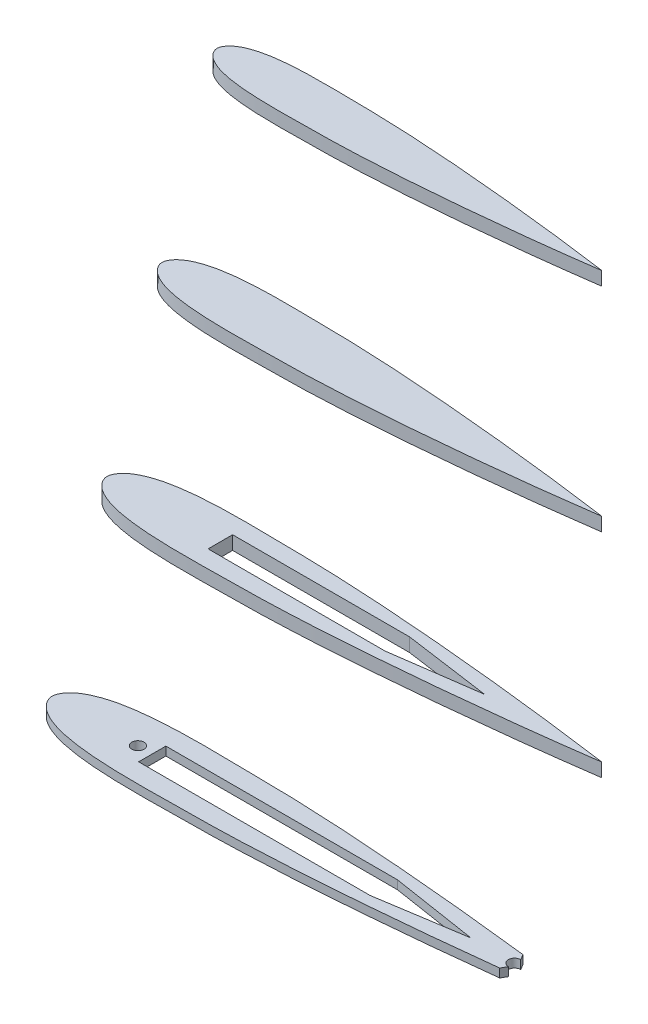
SolidWorks part; units mm, degrees
ref_plane "Front Plane" through (0, 0, 0) normal (0, 0, 1) x (1, 0, 0)
ref_plane "Top Plane" through (0, 0, 0) normal (0, 1, 0) x (1, 0, 0)
ref_plane "Right Plane" through (0, 0, 0) normal (1, 0, 0) x (0, 0, -1)
sketch "Sketch1" plane through (0, 0, 0) normal (0, 1, 0) x (1, 0, 0)
  line L0 (-1.045, -0.5826) -> (-1.018, -0.5993)
  spline S0 degree 3 poles (-1.045, -0.5826) (-4.9621, -0.0429) (-12.2075, 0.9632) (-22.7943, 2.3133) (-32.7945, 3.5249) (-46.1237, 5.0426) (-59.4574, 6.4326) (-72.7951, 7.6863) (-82.7953, 8.5461) (-92.7951, 9.3271) (-102.8619, 10.0159) (-112.9283, 10.6053) (-122.9958, 11.0416) (-132.9965, 11.3641) (-141.266, 11.3585) (-147.865, 11.5121) (-156.1318, 11.6272) (-166.1409, 11.6323) (-176.149, 11.1038) (-182.4812, 10.3989) (-186.8231, 9.6869) (-190.1592, 8.9277) (-192.8179, 8.1239) (-194.8303, 7.3884) (-196.8545, 6.4661) (-198.9145, 5.2576) (-200.6234, 3.8444) (-202.1284, 1.9526) (-203.2362, -0.5928) (-202.1284, -3.1381) (-200.6234, -5.0299) (-198.9145, -6.4432) (-196.8545, -7.6516) (-194.8303, -8.5739) (-192.8179, -9.3094) (-190.1592, -10.1132) (-186.8231, -10.8724) (-182.4812, -11.5844) (-176.149, -12.2893) (-166.1409, -12.8178) (-156.1318, -12.8128) (-147.865, -12.6976) (-141.266, -12.544) (-132.9965, -12.5496) (-122.9958, -12.2272) (-112.9283, -11.7908) (-102.8619, -11.2014) (-92.7951, -10.5127) (-82.7953, -9.7316) (-72.7951, -8.8718) (-59.4574, -7.6181) (-46.1237, -6.2281) (-32.7945, -4.7104) (-22.7943, -3.4989) (-12.1985, -2.1475) (-4.9442, -1.1402) (-1.018, -0.5993) knots -0.004321 -0.004321 -0.004321 -0.004321 0.024634 0.049243 0.07383 0.098397 0.147479 0.171995 0.196494 0.220976 0.245442 0.27038 0.294813 0.319232 0.343642 0.35536 0.367566 0.404183 0.428636 0.44092 0.450818 0.460843 0.465946 0.471149 0.476523 0.482208 0.488618 0.492568 0.5 0.507432 0.511382 0.517792 0.523477 0.528851 0.534054 0.539157 0.549182 0.55908 0.571364 0.595817 0.632434 0.64464 0.656358 0.680768 0.705187 0.72962 0.754558 0.779024 0.803506 0.828005 0.852521 0.901603 0.92617 0.950757 0.975366 1.004387 1.004387 1.004387 1.004387
ref_plane "Plane1" through (0, 234.38, 0) normal (0, 1, 0) x (1, 0, 0)
sketch "Sketch2" plane through (0, 234.38, 0) normal (0, 1, 0) x (1, 0, 0)
  line L0 (-1.045, -0.5826) -> (-1.0261, -0.5942)
  line L1 (-1.045, -0.5826) -> (-142.2725, -0.5826) construction
  spline S0 degree 3 poles (-1.045, -0.5826) (-3.787, -0.2048) (-8.8587, 0.4995) (-16.2695, 1.4446) (-23.2696, 2.2927) (-32.6001, 3.355) (-41.9337, 4.328) (-51.27, 5.2056) (-58.2702, 5.8075) (-65.2701, 6.3542) (-72.3168, 6.8363) (-79.3633, 7.2489) (-86.4106, 7.5544) (-93.411, 7.7801) (-99.1997, 7.7762) (-103.819, 7.8837) (-109.6058, 7.9643) (-116.6121, 7.9678) (-123.6178, 7.5979) (-128.0503, 7.1044) (-131.0897, 6.6061) (-133.4249, 6.0746) (-135.286, 5.5119) (-136.6947, 4.9971) (-138.1116, 4.3515) (-139.5537, 3.5056) (-140.7499, 2.5163) (-141.8034, 1.1921) (-142.5788, -0.5897) (-141.8034, -2.3715) (-140.7499, -3.6957) (-139.5537, -4.685) (-138.1116, -5.5309) (-136.6947, -6.1765) (-135.286, -6.6913) (-133.4249, -7.254) (-131.0897, -7.7855) (-128.0503, -8.2838) (-123.6178, -8.7773) (-116.6121, -9.1472) (-109.6058, -9.1437) (-103.819, -9.0631) (-99.1997, -8.9555) (-93.411, -8.9595) (-86.4106, -8.7338) (-79.3633, -8.4283) (-72.3168, -8.0157) (-65.2701, -7.5336) (-58.2702, -6.9869) (-51.27, -6.385) (-41.9337, -5.5074) (-32.6001, -4.5344) (-23.2696, -3.4721) (-16.2695, -2.624) (-8.8524, -1.678) (-3.7744, -0.9729) (-1.0261, -0.5942) knots -0.004321 -0.004321 -0.004321 -0.004321 0.024634 0.049243 0.07383 0.098397 0.147479 0.171995 0.196494 0.220976 0.245442 0.27038 0.294813 0.319232 0.343642 0.35536 0.367566 0.404183 0.428636 0.44092 0.450818 0.460843 0.465946 0.471149 0.476523 0.482208 0.488618 0.492568 0.5 0.507432 0.511382 0.517792 0.523477 0.528851 0.534054 0.539157 0.549182 0.55908 0.571364 0.595817 0.632434 0.64464 0.656358 0.680768 0.705187 0.72962 0.754558 0.779024 0.803506 0.828005 0.852521 0.901603 0.92617 0.950757 0.975366 1.004387 1.004387 1.004387 1.004387
  point P2 (-1.045, -0.5826)
ref_plane "Plane3" through (0, 78.126, 0) normal (0, 1, 0) x (1, 0, 0)
ref_plane "Plane4" through (0, 156.252, 0) normal (0, 1, 0) x (1, 0, 0)
sketch "Sketch3" plane through (0, 78.126, 0) normal (0, 1, 0) x (1, 0, 0)
  line L0 (-1.045, -0.5826) -> (-1.0207, -0.5976)
  line L1 (-1.045, -0.5826) -> (-182.6232, -0.5826) construction
  spline S0 degree 3 poles (-1.045, -0.5826) (-4.5704, -0.0968) (-11.0912, 0.8086) (-20.6194, 2.0238) (-29.6195, 3.1142) (-41.6159, 4.4801) (-53.6162, 5.7311) (-65.62, 6.8594) (-74.6202, 7.6332) (-83.6201, 8.3362) (-92.6802, 8.956) (-101.74, 9.4865) (-110.8008, 9.8792) (-119.8013, 10.1694) (-127.2439, 10.1644) (-133.183, 10.3027) (-140.6231, 10.4063) (-149.6313, 10.4108) (-158.6386, 9.9351) (-164.3375, 9.3007) (-168.2453, 8.66) (-171.2477, 7.9767) (-173.6406, 7.2532) (-175.4518, 6.5913) (-177.2735, 5.7612) (-179.1276, 4.6736) (-180.6656, 3.4017) (-182.0201, 1.6991) (-183.0171, -0.5917) (-182.0201, -2.8826) (-180.6656, -4.5851) (-179.1276, -5.8571) (-177.2735, -6.9447) (-175.4518, -7.7747) (-173.6406, -8.4367) (-171.2477, -9.1602) (-168.2453, -9.8434) (-164.3375, -10.4842) (-158.6386, -11.1186) (-149.6313, -11.5943) (-140.6231, -11.5897) (-133.183, -11.4861) (-127.2439, -11.3478) (-119.8013, -11.3529) (-110.8008, -11.0627) (-101.74, -10.67) (-92.6802, -10.1395) (-83.6201, -9.5196) (-74.6202, -8.8167) (-65.62, -8.0429) (-53.6162, -6.9145) (-41.6159, -5.6635) (-29.6195, -4.2976) (-20.6194, -3.2072) (-11.0832, -1.991) (-4.5543, -1.0844) (-1.0207, -0.5976) knots -0.004321 -0.004321 -0.004321 -0.004321 0.024634 0.049243 0.07383 0.098397 0.147479 0.171995 0.196494 0.220976 0.245442 0.27038 0.294813 0.319232 0.343642 0.35536 0.367566 0.404183 0.428636 0.44092 0.450818 0.460843 0.465946 0.471149 0.476523 0.482208 0.488618 0.492568 0.5 0.507432 0.511382 0.517792 0.523477 0.528851 0.534054 0.539157 0.549182 0.55908 0.571364 0.595817 0.632434 0.64464 0.656358 0.680768 0.705187 0.72962 0.754558 0.779024 0.803506 0.828005 0.852521 0.901603 0.92617 0.950757 0.975366 1.004387 1.004387 1.004387 1.004387
  point P2 (-1.045, -0.5826)
sketch "Sketch4" plane through (0, 156.252, 0) normal (0, 1, 0) x (1, 0, 0)
  line L0 (-1.045, -0.5826) -> (-1.0234, -0.5959)
  line L1 (-1.045, -0.5826) -> (-162.4478, -0.5826) construction
  spline S0 degree 3 poles (-1.045, -0.5826) (-4.1787, -0.1508) (-9.975, 0.654) (-18.4445, 1.7342) (-26.4446, 2.7034) (-37.108, 3.9175) (-47.7749, 5.0296) (-58.445, 6.0325) (-66.4452, 6.7204) (-74.4451, 7.3452) (-82.4985, 7.8962) (-90.5517, 8.3677) (-98.6057, 8.7168) (-106.6062, 8.9748) (-113.2218, 8.9703) (-118.501, 9.0932) (-125.1144, 9.1853) (-133.1217, 9.1893) (-141.1282, 8.7665) (-146.1939, 8.2026) (-149.6675, 7.633) (-152.3363, 7.0257) (-154.4633, 6.3826) (-156.0732, 5.7942) (-157.6926, 5.0564) (-159.3406, 4.0896) (-160.7077, 2.959) (-161.9117, 1.4456) (-162.7979, -0.5907) (-161.9117, -2.627) (-160.7077, -4.1404) (-159.3406, -5.271) (-157.6926, -6.2378) (-156.0732, -6.9756) (-154.4633, -7.564) (-152.3363, -8.2071) (-149.6675, -8.8145) (-146.1939, -9.384) (-141.1282, -9.9479) (-133.1217, -10.3707) (-125.1144, -10.3667) (-118.501, -10.2746) (-113.2218, -10.1517) (-106.6062, -10.1562) (-98.6057, -9.8982) (-90.5517, -9.5491) (-82.4985, -9.0776) (-74.4451, -8.5266) (-66.4452, -7.9018) (-58.445, -7.214) (-47.7749, -6.211) (-37.108, -5.099) (-26.4446, -3.8849) (-18.4445, -2.9156) (-9.9678, -1.8345) (-4.1643, -1.0286) (-1.0234, -0.5959) knots -0.004321 -0.004321 -0.004321 -0.004321 0.024634 0.049243 0.07383 0.098397 0.147479 0.171995 0.196494 0.220976 0.245442 0.27038 0.294813 0.319232 0.343642 0.35536 0.367566 0.404183 0.428636 0.44092 0.450818 0.460843 0.465946 0.471149 0.476523 0.482208 0.488618 0.492568 0.5 0.507432 0.511382 0.517792 0.523477 0.528851 0.534054 0.539157 0.549182 0.55908 0.571364 0.595817 0.632434 0.64464 0.656358 0.680768 0.705187 0.72962 0.754558 0.779024 0.803506 0.828005 0.852521 0.901603 0.92617 0.950757 0.975366 1.004387 1.004387 1.004387 1.004387
  point P0 (-1.045, -0.5826)
extrude "Boss-Extrude1" add sketch "Sketch1" along normal blind 3.175 contours S0 L0
extrude "Boss-Extrude2" add sketch "Sketch3" along normal blind 5 separate body contours S0 L0
extrude "Boss-Extrude3" add sketch "Sketch4" along normal blind 5 separate body contours S0 L0
extrude "Boss-Extrude5" add sketch "Sketch2" along normal blind 5 separate body contours S0 L0
sketch "Sketch6" plane through (0, 0, 0) normal (0, 1, 0) x (1, 0, 0)
  line L0 (-1.045, -0.5826) -> (-202.7986, -0.5826) construction
  line L1 (-81.045, 4.4174) -> (-49.0634, -0.5826)
  line L3 (-166.045, -0.5826) -> (-166.045, 4.4174)
  line L4 (-166.045, 4.4174) -> (-81.045, 4.4174)
  line L7 (-166.045, -0.5826) -> (-166.045, -5.5826)
  line L8 (-166.045, -5.5826) -> (-81.045, -5.5826)
  line L10 (-81.045, -5.5826) -> (-49.0634, -0.5826)
  circle A0 centre (-33.045, -0.5826) radius 2.25
  spline S0 degree 3 poles (-1.045, -0.5826) (-4.9621, -0.0429) (-12.2075, 0.9632) (-22.7943, 2.3133) (-32.7945, 3.5249) (-46.1237, 5.0426) (-59.4574, 6.4326) (-72.7951, 7.6863) (-82.7953, 8.5461) (-92.7951, 9.3271) (-102.8619, 10.0159) (-112.9283, 10.6053) (-122.9958, 11.0416) (-132.9965, 11.3641) (-141.266, 11.3585) (-147.865, 11.5121) (-156.1318, 11.6272) (-166.1409, 11.6323) (-176.149, 11.1038) (-182.4812, 10.3989) (-186.8231, 9.6869) (-190.1592, 8.9277) (-192.8179, 8.1239) (-194.8303, 7.3884) (-196.8545, 6.4661) (-198.9145, 5.2576) (-200.6234, 3.8444) (-202.1284, 1.9526) (-203.2362, -0.5928) (-202.1284, -3.1381) (-200.6234, -5.0299) (-198.9145, -6.4432) (-196.8545, -7.6516) (-194.8303, -8.5739) (-192.8179, -9.3094) (-190.1592, -10.1132) (-186.8231, -10.8724) (-182.4812, -11.5844) (-176.149, -12.2893) (-166.1409, -12.8178) (-156.1318, -12.8128) (-147.865, -12.6976) (-141.266, -12.544) (-132.9965, -12.5496) (-122.9958, -12.2272) (-112.9283, -11.7908) (-102.8619, -11.2014) (-92.7951, -10.5127) (-82.7953, -9.7316) (-72.7951, -8.8718) (-59.4574, -7.6181) (-46.1237, -6.2281) (-32.7945, -4.7104) (-22.7943, -3.4989) (-12.1985, -2.1475) (-4.9442, -1.1402) (-1.018, -0.5993) knots -0.004321 -0.004321 -0.004321 -0.004321 0.024634 0.049243 0.07383 0.098397 0.147479 0.171995 0.196494 0.220976 0.245442 0.27038 0.294813 0.319232 0.343642 0.35536 0.367566 0.404183 0.428636 0.44092 0.450818 0.460843 0.465946 0.471149 0.476523 0.482208 0.488618 0.492568 0.5 0.507432 0.511382 0.517792 0.523477 0.528851 0.534054 0.539157 0.549182 0.55908 0.571364 0.595817 0.632434 0.64464 0.656358 0.680768 0.705187 0.72962 0.754558 0.779024 0.803506 0.828005 0.852521 0.901603 0.92617 0.950757 0.975366 1.004387 1.004387 1.004387 1.004387 construction
  dimension "D6" = 4.5
  dimension "D1" = 5
  dimension "D2" = 5
  dimension "D3" = 85
  dimension "D4" = 80
  dimension "D5" = 85
  dimension "D7" = 32
extrude "Cut-Extrude1" cut sketch "Sketch6" along normal blind 5
sketch "Sketch9" plane through (0, 3.175, 0) normal (0, 1, 0) x (1, 0, 0)
  line L0 (-166.045, -0.5826) -> (-176.545, -0.5826) construction
  line L1 (-166.045, 4.4174) -> (-166.045, -5.5826) construction
  circle A0 centre (-171.295, -0.5826) radius 2.25
  dimension "D1" = 4.5
  dimension "D2" = 5.25
extrude "Cut-Extrude3" cut sketch "Sketch9" against normal through all contours A0
sketch "Sketch7" plane through (0, 78.126, 0) normal (0, 1, 0) x (1, 0, 0)
  line L0 (-1.045, -0.5826) -> (-182.6232, -0.5826) construction
  line L1 (-76.045, 3.9174) -> (-44.0576, -0.5826)
  line L3 (-141.045, -0.5826) -> (-141.045, 3.9174)
  line L4 (-141.045, 3.9174) -> (-76.045, 3.9174)
  line L7 (-141.045, -0.5826) -> (-141.045, -5.0826)
  line L8 (-141.045, -5.0826) -> (-76.045, -5.0826)
  line L10 (-76.045, -5.0826) -> (-44.0576, -0.5826)
  spline S0 degree 3 poles (-1.045, -0.5826) (-4.5704, -0.0968) (-11.0912, 0.8086) (-20.6194, 2.0238) (-29.6195, 3.1142) (-41.6159, 4.4801) (-53.6162, 5.7311) (-65.62, 6.8594) (-74.6202, 7.6332) (-83.6201, 8.3362) (-92.6802, 8.956) (-101.74, 9.4865) (-110.8008, 9.8792) (-119.8013, 10.1694) (-127.2439, 10.1644) (-133.183, 10.3027) (-140.6231, 10.4063) (-149.6313, 10.4108) (-158.6386, 9.9351) (-164.3375, 9.3007) (-168.2453, 8.66) (-171.2477, 7.9767) (-173.6406, 7.2532) (-175.4518, 6.5913) (-177.2735, 5.7612) (-179.1276, 4.6736) (-180.6656, 3.4017) (-182.0201, 1.6991) (-183.0171, -0.5917) (-182.0201, -2.8826) (-180.6656, -4.5851) (-179.1276, -5.8571) (-177.2735, -6.9447) (-175.4518, -7.7747) (-173.6406, -8.4367) (-171.2477, -9.1602) (-168.2453, -9.8434) (-164.3375, -10.4842) (-158.6386, -11.1186) (-149.6313, -11.5943) (-140.6231, -11.5897) (-133.183, -11.4861) (-127.2439, -11.3478) (-119.8013, -11.3529) (-110.8008, -11.0627) (-101.74, -10.67) (-92.6802, -10.1395) (-83.6201, -9.5196) (-74.6202, -8.8167) (-65.62, -8.0429) (-53.6162, -6.9145) (-41.6159, -5.6635) (-29.6195, -4.2976) (-20.6194, -3.2072) (-11.0832, -1.991) (-4.5543, -1.0844) (-1.0207, -0.5976) knots -0.004321 -0.004321 -0.004321 -0.004321 0.024634 0.049243 0.07383 0.098397 0.147479 0.171995 0.196494 0.220976 0.245442 0.27038 0.294813 0.319232 0.343642 0.35536 0.367566 0.404183 0.428636 0.44092 0.450818 0.460843 0.465946 0.471149 0.476523 0.482208 0.488618 0.492568 0.5 0.507432 0.511382 0.517792 0.523477 0.528851 0.534054 0.539157 0.549182 0.55908 0.571364 0.595817 0.632434 0.64464 0.656358 0.680768 0.705187 0.72962 0.754558 0.779024 0.803506 0.828005 0.852521 0.901603 0.92617 0.950757 0.975366 1.004387 1.004387 1.004387 1.004387 construction
  dimension "D1" = 65
  dimension "D2" = 4.5
  dimension "D3" = 4.5
  dimension "D4" = 75
  dimension "D5" = 65
extrude "Cut-Extrude2" cut sketch "Sketch7" along normal blind 5 contours L7 L8 L10 L1 L4 L3
sketch "Sketch8" plane through (0, 239.38, 0) normal (0, 1, 0) x (1, 0, 0)
  line L0 (-1.045, -0.5826) -> (-75.6006, -0.5826) construction
  circle A0 centre (-33.045, -0.5826) radius 2.25
  dimension "D1" = 4.5
  dimension "D2" = 32
sketch "Sketch10" plane through (0, 83.126, 0) normal (0, 1, 0) x (1, 0, 0)
  line L0 (-141.045, -0.5826) -> (-151.545, -0.5826) construction
  line L1 (-141.045, -5.0826) -> (-141.045, 3.9174) construction
  circle A0 centre (-146.295, -0.5826) radius 2.25
  dimension "D2" = 4.5
  dimension "D1" = 5.25
sketch "Sketch11" plane through (0, 161.252, 0) normal (0, 1, 0) x (1, 0, 0)
  line L0 (-1.0234, -0.5959) -> (-152.7749, -0.5959) construction
  circle A0 centre (-121.0234, -0.5959) radius 2.25
  dimension "D1" = 4.5
  dimension "D2" = 120
sketch "Sketch12" plane through (0, 3.175, 0) normal (0, 1, 0) x (1, 0, 0)
  line L1 (-1.018, -0.5993) -> (-1.045, -0.5826)
  line L2 (-1.018, -0.5993) -> (-1.045, -0.5826)
  line L3 (-33.045, -12.2975) -> (2.9259, -12.2975)
  line L4 (-33.045, -12.2975) -> (-33.045, 9.059)
  line L5 (-33.045, 9.059) -> (2.9259, 9.059)
  line L6 (2.9259, -12.2975) -> (2.9259, 9.059)
  spline S0 degree 3 poles (-33.045, -4.7277) (-32.9628, -4.718) (-29.546, -4.3169) (-22.7943, -3.4989) (-12.1985, -2.1475) (-4.9442, -1.1402) (-1.018, -0.5993) knots 0.925565 0.925565 0.925565 0.925565 0.92617 0.950757 0.975366 1.004387 1.004387 1.004387 1.004387
  spline S1 degree 3 poles (1650.9665, 6751.892) (473.3333, -160.6038) (233.4814, -30.3704) (-22.7943, 2.3133) (-32.7945, 3.5249) (-46.1237, 5.0426) (-59.4574, 6.4326) (-72.7951, 7.6863) (-82.7953, 8.5461) (-92.7951, 9.3271) (-102.8619, 10.0159) (-112.9283, 10.6053) (-122.9958, 11.0416) (-132.9965, 11.3641) (-141.266, 11.3585) (-147.865, 11.5121) (-156.1318, 11.6272) (-166.1409, 11.6323) (-176.149, 11.1038) (-182.4812, 10.3989) (-186.8231, 9.6869) (-190.1592, 8.9277) (-192.8179, 8.1239) (-194.8303, 7.3884) (-196.8545, 6.4661) (-198.9145, 5.2576) (-200.6234, 3.8444) (-202.1284, 1.9526) (-203.2362, -0.5928) (-202.1284, -3.1381) (-200.6234, -5.0299) (-198.9145, -6.4432) (-196.8545, -7.6516) (-194.8303, -8.5739) (-192.8179, -9.3094) (-190.1592, -10.1132) (-186.8231, -10.8724) (-182.4812, -11.5844) (-176.149, -12.2893) (-166.1409, -12.8178) (-156.1318, -12.8128) (-147.865, -12.6976) (-141.266, -12.544) (-132.9965, -12.5496) (-122.9958, -12.2272) (-112.9283, -11.7908) (-102.8619, -11.2014) (-92.7951, -10.5127) (-82.7953, -9.7316) (-72.7951, -8.8718) (-59.4574, -7.6181) (-46.1237, -6.2281) (-32.7945, -4.7104) (-22.7943, -3.4989) (233.4856, 29.1854) (473.3413, 159.4226) (1651.0264, -6753.4289) knots -1.817962 -1.817962 -1.817962 -1.817962 0.024634 0.049243 0.07383 0.098397 0.147479 0.171995 0.196494 0.220976 0.245442 0.27038 0.294813 0.319232 0.343642 0.35536 0.367566 0.404183 0.428636 0.44092 0.450818 0.460843 0.465946 0.471149 0.476523 0.482208 0.488618 0.492568 0.5 0.507432 0.511382 0.517792 0.523477 0.528851 0.534054 0.539157 0.549182 0.55908 0.571364 0.595817 0.632434 0.64464 0.656358 0.680768 0.705187 0.72962 0.754558 0.779024 0.803506 0.828005 0.852521 0.901603 0.92617 0.950757 0.975366 2.817994 2.817994 2.817994 2.817994 only from (-1.045, -0.5826) to (-1.018, -0.5993)
  spline S2 degree 3 poles (-1.045, -0.5826) (-4.9621, -0.0429) (-12.2075, 0.9632) (-22.7943, 2.3133) (-29.546, 3.1313) (-32.9628, 3.5325) (-33.045, 3.5422) knots -0.004321 -0.004321 -0.004321 -0.004321 0.024634 0.049243 0.07383 0.074435 0.074435 0.074435 0.074435
  dimension "D1" = 0
extrude "Cut-Extrude5" cut sketch "Sketch12" against normal through all both and the other way through all
sketch "Sketch13" plane through (0, 3.175, 0) normal (0, 1, 0) x (1, 0, 0)
  line L0 (-33.045, 1.6674) -> (-34.2057, 3.6779)
  line L1 (-33.045, -2.8326) -> (-34.2183, -4.8648)
  line L2 (-33.045, 1.6674) -> (-33.045, 3.5422)
  line L3 (-33.045, -4.7277) -> (-33.045, -2.8326)
  line L4 (-33.045, 1.6674) -> (-33.045, 3.5422)
  line L5 (-33.045, -4.7277) -> (-33.045, -2.8326)
  arc A1 (-33.045, 1.6674) -> (-33.045, -2.8326) centre (-33.045, -0.5826) ccw
  spline S0 degree 3 poles (-34.2183, -4.8648) (-33.8272, -4.8193) (-33.4361, -4.7736) (-33.045, -4.7277) knots 0.922681 0.922681 0.922681 0.922681 0.925565 0.925565 0.925565 0.925565
  spline S1 degree 3 poles (461.0634, -6780.2492) (992.447, -382.5704) (483.4141, -50.161) (-59.4574, 6.4326) (-72.7951, 7.6863) (-82.7953, 8.5461) (-92.7951, 9.3271) (-102.8619, 10.0159) (-112.9283, 10.6053) (-122.9958, 11.0416) (-132.9965, 11.3641) (-141.266, 11.3585) (-147.865, 11.5121) (-156.1318, 11.6272) (-166.1409, 11.6323) (-176.149, 11.1038) (-182.4812, 10.3989) (-186.8231, 9.6869) (-190.1592, 8.9277) (-192.8179, 8.1239) (-194.8303, 7.3884) (-196.8545, 6.4661) (-198.9145, 5.2576) (-200.6234, 3.8444) (-202.1284, 1.9526) (-203.2362, -0.5928) (-202.1284, -3.1381) (-200.6234, -5.0299) (-198.9145, -6.4432) (-196.8545, -7.6516) (-194.8303, -8.5739) (-192.8179, -9.3094) (-190.1592, -10.1132) (-186.8231, -10.8724) (-182.4812, -11.5844) (-176.149, -12.2893) (-166.1409, -12.8178) (-156.1318, -12.8128) (-147.865, -12.6976) (-141.266, -12.544) (-132.9965, -12.5496) (-122.9958, -12.2272) (-112.9283, -11.7908) (-102.8619, -11.2014) (-92.7951, -10.5127) (-82.7953, -9.7316) (-72.7951, -8.8718) (-59.4574, -7.6181) (483.4139, 48.9755) (992.4465, 381.3845) (461.0641, 6779.0545) knots -3.824725 -3.824725 -3.824725 -3.824725 0.098397 0.147479 0.171995 0.196494 0.220976 0.245442 0.27038 0.294813 0.319232 0.343642 0.35536 0.367566 0.404183 0.428636 0.44092 0.450818 0.460843 0.465946 0.471149 0.476523 0.482208 0.488618 0.492568 0.5 0.507432 0.511382 0.517792 0.523477 0.528851 0.534054 0.539157 0.549182 0.55908 0.571364 0.595817 0.632434 0.64464 0.656358 0.680768 0.705187 0.72962 0.754558 0.779024 0.803506 0.828005 0.852521 0.901603 4.824724 4.824724 4.824724 4.824724 only from (-33.045, 3.5422) to (-33.045, -4.7277)
  spline S2 degree 3 poles (-33.045, 3.5422) (-33.4318, 3.5876) (-33.8187, 3.6328) (-34.2057, 3.6779) knots 0.074435 0.074435 0.074435 0.074435 0.077288 0.077288 0.077288 0.077288
  dimension "D2" = 30
  dimension "D3" = 30
  dimension "D1" = 0
extrude "Cut-Extrude6" cut sketch "Sketch13" against normal through all both and the other way through all
sketch "Sketch14" plane through (0, 3.175, 0) normal (0, 1, 0) x (1, 0, 0)
  line L0 (-171.295, -0.5826) -> (-202.7986, -0.5826) construction
  spline S0 degree 3 poles (-34.2057, 3.6779) (-37.069, 4.0114) (-46.5934, 5.0915) (-59.4574, 6.4326) (-72.7951, 7.6863) (-82.7953, 8.5461) (-92.7951, 9.3271) (-102.8619, 10.0159) (-112.9283, 10.6053) (-122.9958, 11.0416) (-132.9965, 11.3641) (-141.266, 11.3585) (-147.865, 11.5121) (-156.1318, 11.6272) (-166.1409, 11.6323) (-176.149, 11.1038) (-182.4812, 10.3989) (-186.8231, 9.6869) (-190.1592, 8.9277) (-192.8179, 8.1239) (-194.8303, 7.3884) (-196.8545, 6.4661) (-198.9145, 5.2576) (-200.6234, 3.8444) (-202.1284, 1.9526) (-203.2362, -0.5928) (-202.1284, -3.1381) (-200.6234, -5.0299) (-198.9145, -6.4432) (-196.8545, -7.6516) (-194.8303, -8.5739) (-192.8179, -9.3094) (-190.1592, -10.1132) (-186.8231, -10.8724) (-182.4812, -11.5844) (-176.149, -12.2893) (-166.1409, -12.8178) (-156.1318, -12.8128) (-147.865, -12.6976) (-141.266, -12.544) (-132.9965, -12.5496) (-122.9958, -12.2272) (-112.9283, -11.7908) (-102.8619, -11.2014) (-92.7951, -10.5127) (-82.7953, -9.7316) (-72.7951, -8.8718) (-59.4574, -7.6181) (-46.5977, -6.2775) (-37.0774, -5.1979) (-34.2183, -4.8648) knots 0.077288 0.077288 0.077288 0.077288 0.098397 0.147479 0.171995 0.196494 0.220976 0.245442 0.27038 0.294813 0.319232 0.343642 0.35536 0.367566 0.404183 0.428636 0.44092 0.450818 0.460843 0.465946 0.471149 0.476523 0.482208 0.488618 0.492568 0.5 0.507432 0.511382 0.517792 0.523477 0.528851 0.534054 0.539157 0.549182 0.55908 0.571364 0.595817 0.632434 0.64464 0.656358 0.680768 0.705187 0.72962 0.754558 0.779024 0.803506 0.828005 0.852521 0.901603 0.922681 0.922681 0.922681 0.922681 construction
  dimension "D1" = 31.5036
